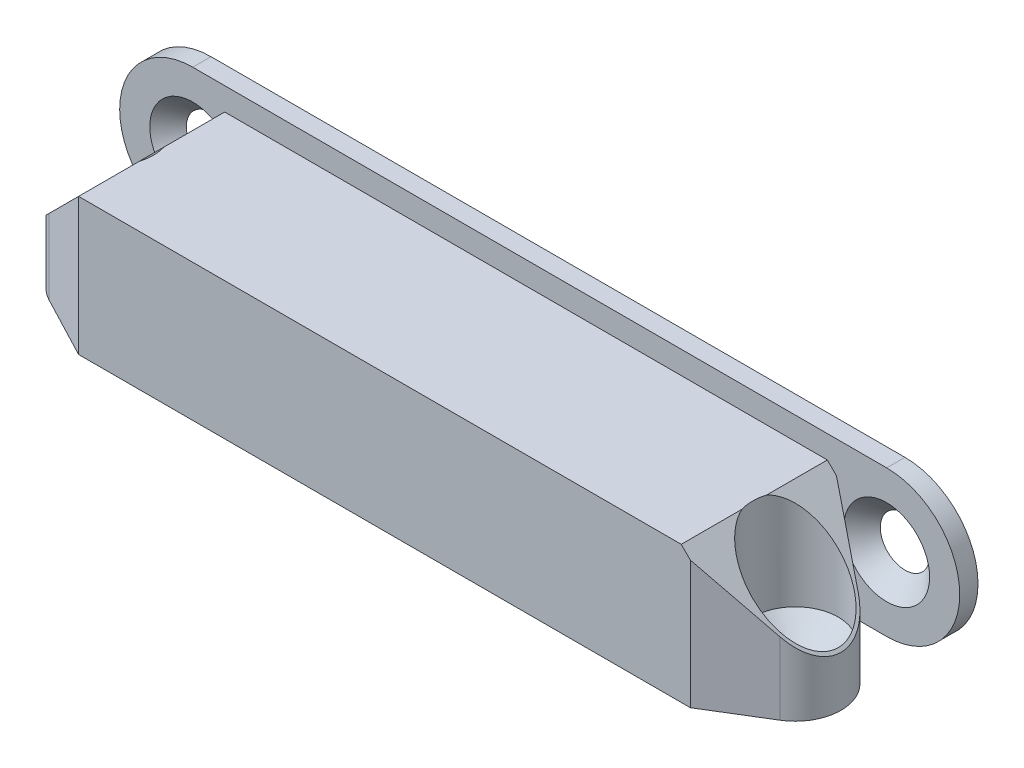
SolidWorks part; units mm, degrees
ref_plane "Plan de face" through (0, 0, 0) normal (0, 0, 1) x (1, 0, 0)
ref_plane "Plan de dessus" through (0, 0, 0) normal (0, 1, 0) x (1, 0, 0)
ref_plane "Plan de droite" through (0, 0, 0) normal (1, 0, 0) x (0, 0, -1)
sketch "Esquisse1" plane through (0, 0, 0) normal (0, 0, 1) x (1, 0, 0)
  line L0 (-38, -8) -> (38, -8)
  line L1 (38, 8) -> (-38, 8)
  arc A0 (38, -8) -> (38, 8) centre (38, 0) ccw
  arc A1 (-38, 8) -> (-38, -8) centre (-38, 0) ccw
  dimension "D1" = 8
  dimension "D2" = 92
  dimension "D3" = 46
extrude "Extrusion1" add sketch "Esquisse1" along normal blind 2
hole_wizard "Fraisage pour vis à tête fraisée M41" positions "Esquisse3" profile "Esquisse2" countersink size "M4" standard "ISO"
sketch "Esquisse3" plane through (0, 0, 2) normal (0, 0, 1) x (1, 0, 0)
  arc A0 (-38, 8) -> (-38, -8) centre (-38, 0) ccw construction
  arc A1 (38, -8) -> (38, 8) centre (38, 0) ccw construction
  point P0 (-38, 0)
  point P1 (38, 0)
sketch "Esquisse2" plane through (-38, 0, 2) normal (1, 0, 0) x (0, -1, 0)
  line L0 (0, 0) -> (0, 11.2919)
  line L1 (0, 11.2919) -> (2.15, 10)
  line L2 (2.15, 10) -> (2.15, 2.55)
  line L3 (2.15, 2.55) -> (4.7, 0)
  line L5 (4.7, 0) -> (0, 0)
  line L6 (-2.15, 2.55) -> (-4.7, 0) construction
  line L10 (0, 11.2919) -> (-2.15, 10) construction
  line L11 (0, -6.35) -> (0, 107.95) construction
  dimension "Diamètre du perçage" = 4.3
  dimension "Profondeur du perçage" = 10
  dimension "Diamètre du fraisage entrant" = 9.4
  dimension "Angle du fraisage entrant" = 90
  dimension "Angle de pointe" = 118
sketch "Esquisse5" plane through (0, -8, 0) normal (0, -1, 0) x (1, 0, 0)
  line L0 (-33, 3.5) -> (34, 3.5)
  line L1 (34, 3.5) -> (40.108, 7.234)
  line L2 (40.108, 15.766) -> (34, 19.5)
  line L3 (34, 19.5) -> (-33, 19.5)
  line L4 (-33, 19.5) -> (-39.8192, 15.9296)
  line L5 (-39.8192, 7.0704) -> (-33, 3.5)
  line L6 (-38, 2) -> (38, 2) construction
  arc A0 (40.108, 7.234) -> (40.108, 15.766) centre (37.5, 11.5) ccw
  arc A1 (-39.8192, 15.9296) -> (-39.8192, 7.0704) centre (-37.5, 11.5) ccw
  dimension "D3" = 85
  dimension "D5" = 5
  dimension "D6" = 5
  dimension "D1" = 16
  dimension "D2" = 1.5
  dimension "D4" = 42.5
  dimension "D7" = 8
  dimension "D8" = 67
  dimension "D9" = 9.5
extrude "Extrusion2" add sketch "Esquisse5" against normal blind 15
sketch "Esquisse6" plane through (0, 0, 19.5) normal (0, 0, 1) x (1, 0, 0)
  line L0 (-33, 7) -> (-48, -8)
  line L1 (-48, -8) -> (-48, 7)
  line L2 (-48, 7) -> (-33, 7)
  dimension "D1" = 45
  dimension "D2" = 15
extrude "Enlèv. mat.-Extru.1" cut sketch "Esquisse6" along direction (0, 0, -1) on the side against the normal up to next (17.5 mm away)
hole_wizard "Fraisage pour vis à tête fraisée M43" positions "Esquisse11" profile "Esquisse10" countersink size "M4" standard "ISO"
sketch "Esquisse11" plane through (0, 7, 0) normal (0, 1, 0) x (-1, 0, 0)
  arc A0 (39.8192, 7.0704) -> (39.8192, 15.9296) centre (37.5, 11.5) ccw construction
  point P0 (37.5, 11.5)
sketch "Esquisse10" plane through (-37.5, 7, 11.5) normal (1, 0, 0) x (0, 0, 1)
  line L0 (0, 0) -> (0, 26.2919)
  line L1 (0, 26.2919) -> (2.15, 25)
  line L2 (2.15, 25) -> (2.15, 13.55)
  line L3 (2.15, 13.55) -> (4.7, 11)
  line L4 (4.7, 11) -> (4.7, 0)
  line L6 (4.7, 0) -> (0, 0)
  line L7 (-2.15, 13.55) -> (-4.7, 11) construction
  line L10 (0, 26.2919) -> (-2.15, 25) construction
  line L11 (0, -6.35) -> (0, 107.95) construction
  dimension "Diamètre du perçage" = 4.3
  dimension "Profondeur du perçage" = 25
  dimension "Diamètre du fraisage" = 9.4
  dimension "Angle du fraisage" = 90
  dimension "Angle de pointe" = 118
  dimension "Dégagement de la tête" = 11
mirror "Symétrie1" about plane through (0, 0, 0) normal (1, 0, 0) of "Fraisage pour vis à tête fraisée M43", "Enlèv. mat.-Extru.1"
delete or keep bodies "Corps-Effacer/suppr1" [suppressed] type delete bodies bodies 102
